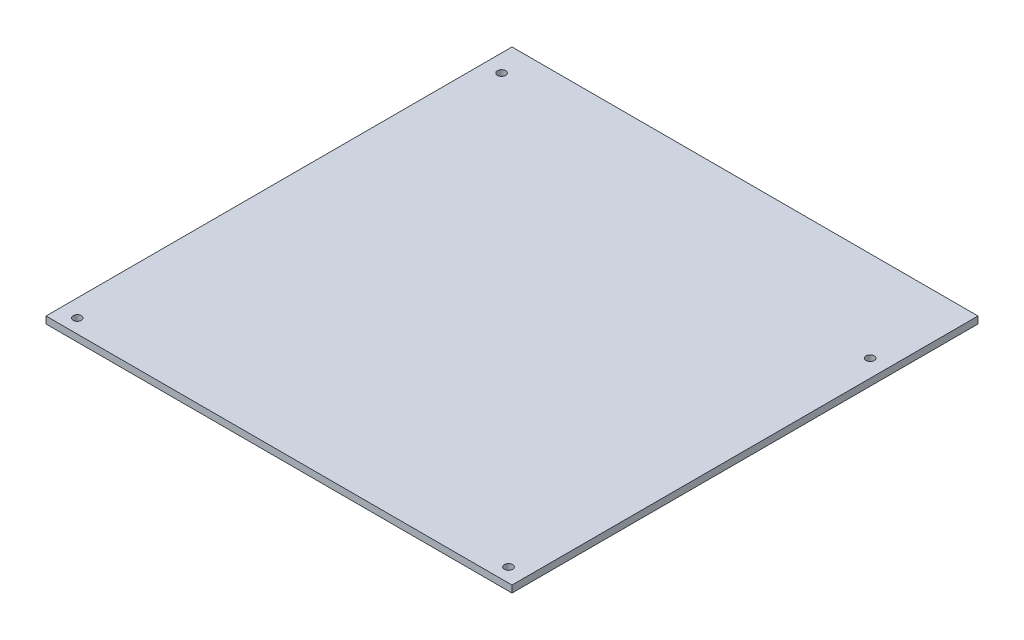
SolidWorks part; units mm, degrees
ref_plane "Спереди" through (0, 0, 0) normal (0, 0, 1) x (1, 0, 0)
ref_plane "Сверху" through (0, 0, 0) normal (0, 1, 0) x (1, 0, 0)
ref_plane "Справа" through (0, 0, 0) normal (1, 0, 0) x (0, 0, -1)
sketch "Sketch1" plane through (0, 0, 0) normal (0, 1, 0) x (1, 0, 0)
  line L1 (-85.09, 0) -> (85.09, 0)
  line L2 (-85.09, 0) -> (-85.09, 170.18)
  line L3 (-85.09, 170.18) -> (85.09, 170.18)
  line L4 (85.09, 0) -> (85.09, 170.18)
  dimension "D1" = 170.18
  dimension "D2" = 170.18
extrude "Extrude1" add sketch "Sketch1" along normal blind 2.54
hole_wizard "Ø3.0 (3) Diameter Hole1" positions "Sketch3" profile "Sketch2" hole size "Ø3.0" standard "ISO"
sketch "Sketch3" plane through (0, 2.54, 0) normal (0, 1, 0) x (1, 0, 0)
  line L0 (85.09, 170.18) -> (-85.09, 170.18) construction
  line L1 (-85.09, 170.18) -> (-85.09, 0) construction
  point P0 (-78.74, 160.02)
  point P6 (-33.02, -67.31)
  point P28 (78.74, 137.16)
  point P58 (78.74, 5.08)
  point P66 (-78.74, 5.08)
  dimension "D1" = 10.16
  dimension "D2" = 6.35
  dimension "D3" = 227.33
  dimension "D4" = 22.86
  dimension "D5" = 157.48
  dimension "D12" = 154.94
sketch "Sketch2" plane through (-78.74, 2.54, -160.02) normal (1, 0, 0) x (0, 0, 1)
  line L0 (0, 0) -> (0, 3.9493)
  line L1 (0, 3.9493) -> (1.5, 3.048)
  line L2 (1.5, 3.048) -> (1.5, 0)
  line L5 (1.5, 0) -> (0, 0)
  line L10 (0, 3.9493) -> (-1.5, 3.048) construction
  line L11 (0, -6.35) -> (0, 107.95) construction
  dimension "Hole Dia." = 3
  dimension "Hole Depth" = 3.048
  dimension "Drill Angle" = 118
